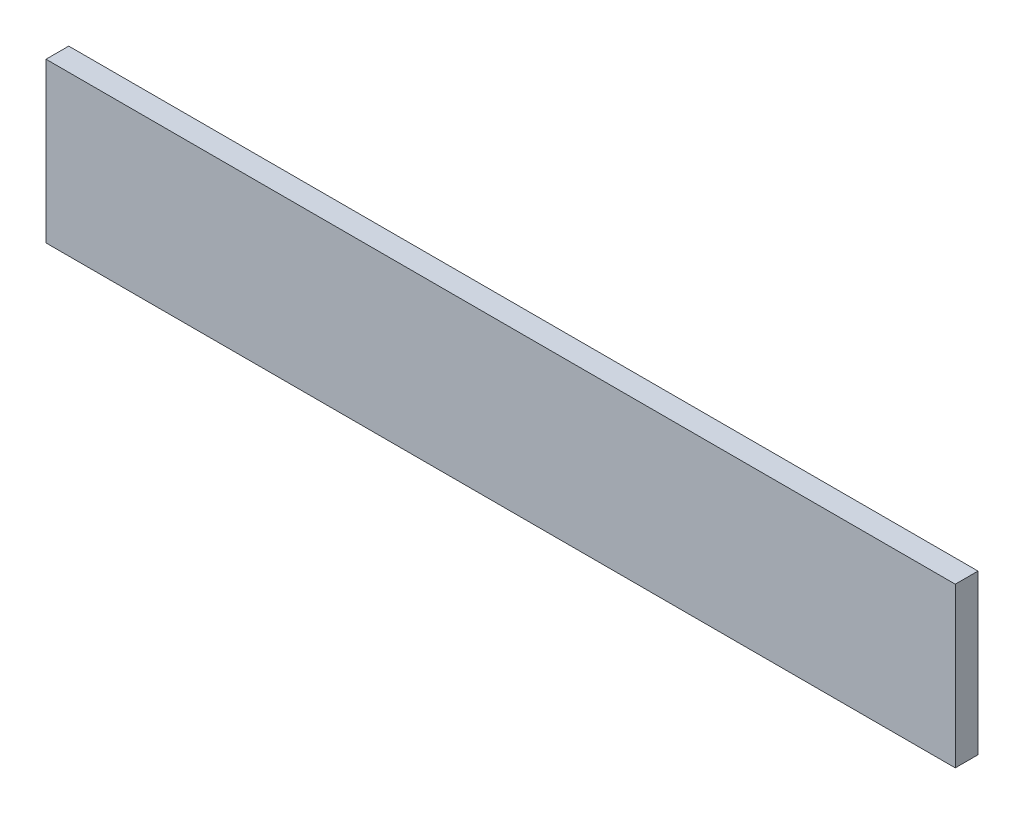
SolidWorks part; units mm, degrees
ref_plane "Front Plane" through (0, 0, 0) normal (0, 0, 1) x (1, 0, 0)
ref_plane "Top Plane" through (0, 0, 0) normal (0, 1, 0) x (1, 0, 0)
ref_plane "Right Plane" through (0, 0, 0) normal (1, 0, 0) x (0, 0, -1)
sketch "Sketch1" plane through (0, 0, 0) normal (0, 0, 1) x (1, 0, 0)
  line L1 (0, 0) -> (254, 0)
  line L2 (0, 0) -> (0, 44.45)
  line L3 (0, 44.45) -> (254, 44.45)
  line L4 (254, 0) -> (254, 44.45)
  dimension "D1" = 254
  dimension "D2" = 44.45
extrude "Boss-Extrude1" add sketch "Sketch1" along normal blind 6.35 contours L3 L4 L1 L2
